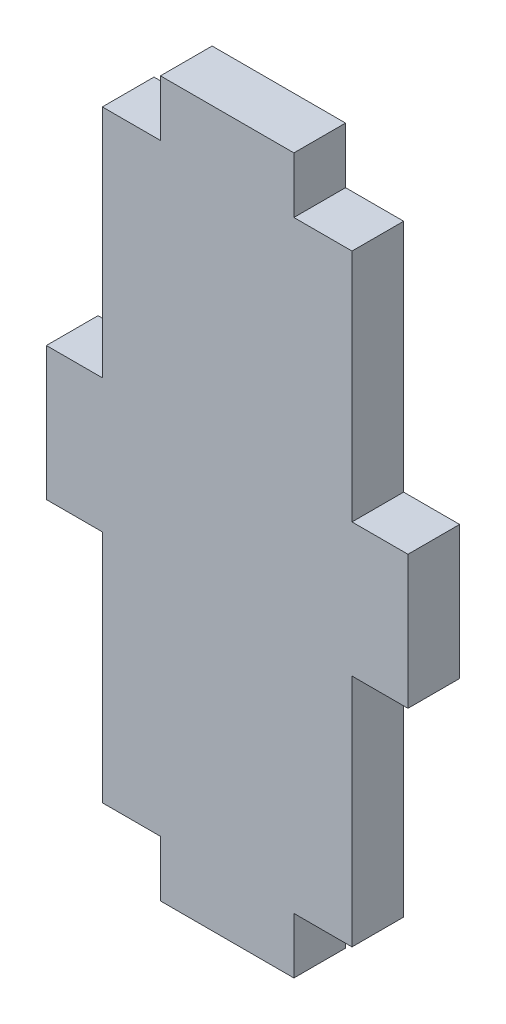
SolidWorks part; units mm, degrees
ref_plane "Front Plane" through (0, 0, 0) normal (0, 0, 1) x (1, 0, 0)
ref_plane "Top Plane" through (0, 0, 0) normal (0, 1, 0) x (1, 0, 0)
ref_plane "Right Plane" through (0, 0, 0) normal (1, 0, 0) x (0, 0, -1)
sketch "Sketch1" plane through (0, 0, 0) normal (0, 0, 1) x (1, 0, 0)
  line L0 (0, 0) -> (0, 60341.1464) construction
  line L1 (0, 0) -> (-50000, 0) construction
  line L2 (-14.5, -35) -> (-7.75, -35)
  line L3 (-14.5, -35) -> (-14.5, -7.75)
  line L4 (-14.5, 35) -> (-7.75, 35)
  line L5 (14.5, -35) -> (14.5, -7.75)
  line L6 (-14.5, -35) -> (14.5, 35) construction
  line L7 (-14.5, 35) -> (14.5, -35) construction
  line L9 (-7.75, 35) -> (-7.75, 41.5)
  line L10 (-7.75, 41.5) -> (7.75, 41.5)
  line L11 (7.75, 35) -> (7.75, 41.5)
  line L12 (7.75, -35) -> (14.5, -35)
  line L13 (-21, -7.75) -> (-21, 7.75)
  line L19 (-21, -7.75) -> (-14.5, -7.75)
  line L21 (-21, 7.75) -> (-14.5, 7.75)
  line L22 (-8, -7.75) -> (-8, 7.75) construction
  line L23 (14.5, 7.75) -> (14.5, 35)
  line L24 (7.75, 35) -> (14.5, 35)
  line L25 (14.5, 7.75) -> (21, 7.75)
  line L27 (21, 7.75) -> (21, -7.75)
  line L30 (-7.75, -41.5) -> (7.75, -41.5)
  line L31 (-7.75, -35) -> (-7.75, -41.5)
  line L32 (7.75, -35) -> (7.75, -41.5)
  line L33 (21, -7.75) -> (14.5, -7.75)
  line L36 (-14.5, 7.75) -> (-14.5, 35)
  point P3 (0, 0)
  point P8 (0, 35)
  point P12 (0, 41.5)
  point P13 (0, -35)
  point P16 (-27.5, 0)
  point P19 (-8, 0)
  point P27 (0, -41.5)
  dimension "D1" = 29
  dimension "D2" = 70
  dimension "D3" = 6.5
  dimension "D4" = 15.5
  dimension "D5" = 6.5
  dimension "D6" = 15.5
  dimension "D8" = 6.5
  dimension "D9" = 6.5
extrude "Boss-Extrude1" add sketch "Sketch1" along normal blind 6
